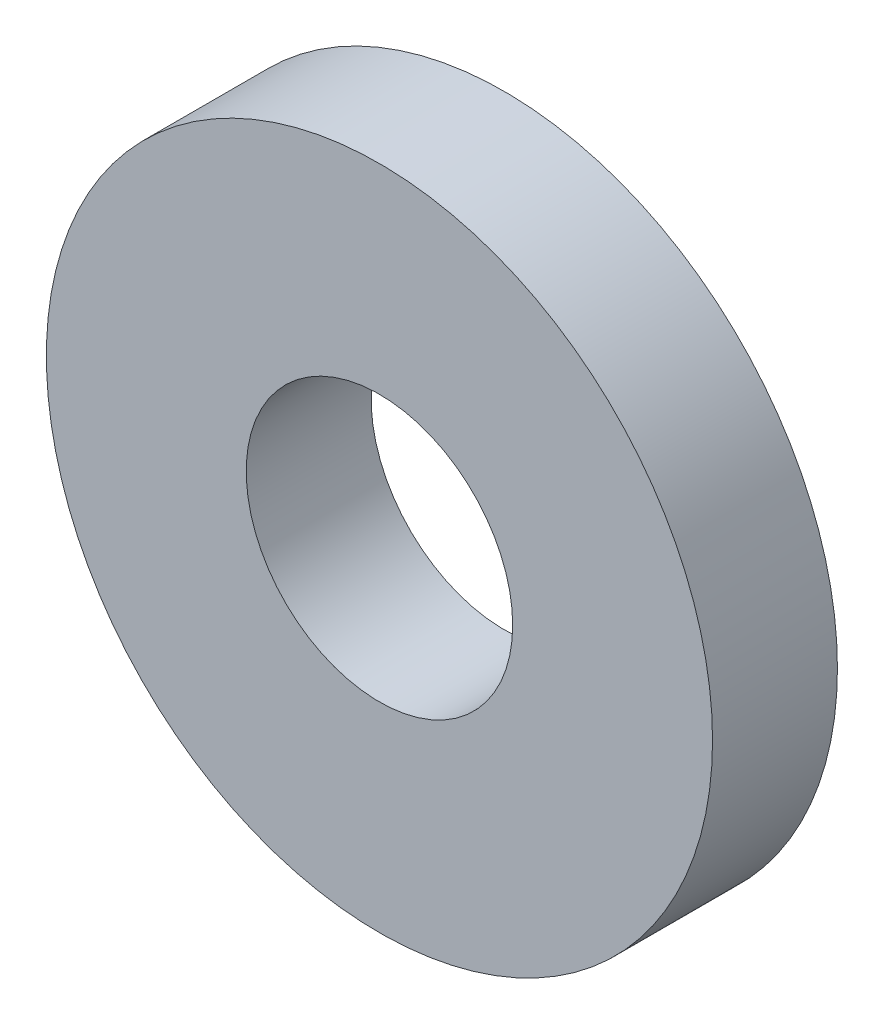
SolidWorks part; units mm, degrees
ref_plane "Front Plane" through (0, 0, 0) normal (0, 0, 1) x (1, 0, 0)
ref_plane "Top Plane" through (0, 0, 0) normal (0, 1, 0) x (1, 0, 0)
ref_plane "Right Plane" through (0, 0, 0) normal (1, 0, 0) x (0, 0, -1)
sketch "Sketch1" plane through (0, 0, 0) normal (0, 0, 1) x (1, 0, 0)
  circle A0 centre (0, 0) radius 4
  circle A1 centre (0, 0) radius 1.6
  dimension "D1" = 3.2
  dimension "D2" = 8
extrude "Boss-Extrude1" add sketch "Sketch1" along normal blind 1.5
